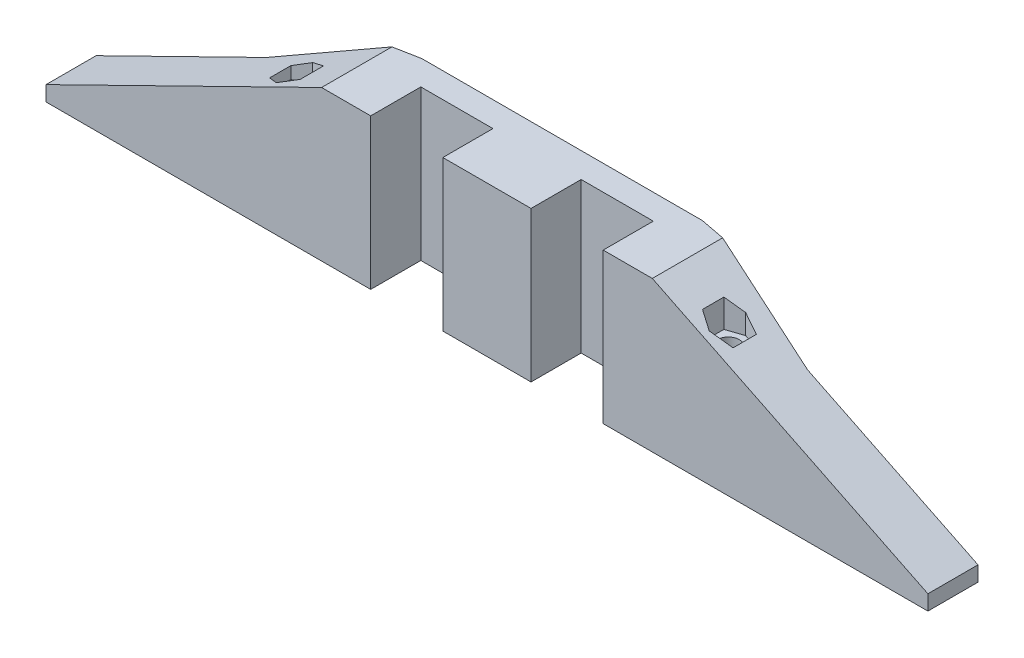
SolidWorks part; units mm, degrees
ref_plane "Спереди" through (0, 0, 0) normal (0, 0, 1) x (1, 0, 0)
ref_plane "Сверху" through (0, 0, 0) normal (0, 1, 0) x (1, 0, 0)
ref_plane "Справа" through (0, 0, 0) normal (1, 0, 0) x (0, 0, -1)
other "Configuration Table"
sketch "Эскиз1" plane through (0, 0, 0) normal (0, 1, 0) x (1, 0, 0)
  line L0 (-48.2163, 22.9032) -> (-72.2163, 22.9032)
  line L1 (-72.2163, 22.9032) -> (-72.2163, 7.9032)
  line L2 (-72.2163, 7.9032) -> (-67.4163, 7.9032)
  line L3 (-67.4163, 7.9032) -> (-67.4163, 17.9032)
  line L4 (-67.4163, 17.9032) -> (-53.0163, 17.9032)
  line L5 (-53.0163, 17.9032) -> (-53.0163, 7.9032)
  line L6 (-53.0163, 7.9032) -> (-48.2163, 7.9032)
  line L7 (-48.2163, 7.9032) -> (-48.2163, 22.9032)
  line L8 (-40.2163, 22.9032) -> (-40.2163, 7.9032)
  line L9 (-40.2163, 7.9032) -> (-35.4163, 7.9032)
  line L10 (-35.4163, 7.9032) -> (-35.4163, 17.9032)
  line L11 (-35.4163, 17.9032) -> (-21.0163, 17.9032)
  line L12 (-21.0163, 17.9032) -> (-21.0163, 7.9032)
  line L13 (-21.0163, 7.9032) -> (-16.2163, 7.9032)
  line L14 (-16.2163, 7.9032) -> (-16.2163, 22.9032)
  line L15 (-16.2163, 22.9032) -> (-40.2163, 22.9032)
  dimension "D1" = 24
  dimension "D2" = 15
  dimension "D3" = 15
  dimension "D4" = 24
  dimension "D5" = 4.8
  dimension "D6" = 4.8
  dimension "D7" = 4.8
  dimension "D8" = 4.8
  dimension "D9" = 10
  dimension "D10" = 10
extrude "Бобышка-Вытянуть1" add sketch "Эскиз1" along normal blind 30
sketch "Эскиз2" plane through (-48.2163, 0, 0) normal (1, 0, 0) x (0, 0, -1)
  line L4 (7.9032, 0) -> (22.9032, 0)
  line L5 (22.9032, 0) -> (22.9032, 30)
  line L6 (22.9032, 30) -> (7.9032, 30)
  line L7 (7.9032, 30) -> (7.9032, 0)
  line L8 (7.9032, 0) -> (22.9032, 0)
  line L9 (22.9032, 0) -> (22.9032, 30)
  line L10 (22.9032, 30) -> (7.9032, 30)
  line L11 (7.9032, 30) -> (7.9032, 0)
  dimension "D1" = 0
extrude "Бобышка-Вытянуть2" add sketch "Эскиз2" along normal up to surface (8 mm away)
sketch "Эскиз3" plane through (-72.2163, 0, 0) normal (-1, 0, 0) x (0, 0, 1)
  line L0 (-17.9032, 30) -> (-17.9032, 0) construction
  line L1 (-17.9032, 30) -> (-17.9032, 0)
  line L4 (-22.9032, 0) -> (-7.9032, 0)
  line L5 (-7.9032, 0) -> (-7.9032, 30)
  line L6 (-7.9032, 30) -> (-22.9032, 30)
  line L7 (-22.9032, 30) -> (-22.9032, 0)
  line L8 (-22.9032, 0) -> (-7.9032, 0)
  line L9 (-7.9032, 0) -> (-7.9032, 30)
  line L10 (-7.9032, 30) -> (-22.9032, 30)
  line L11 (-22.9032, 30) -> (-22.9032, 0)
  dimension "D1" = 0
extrude "Бобышка-Вытянуть3" add sketch "Эскиз3" along normal blind 60 contours L1 M7 M5 M6
sketch "Эскиз4" plane through (-16.2163, 0, 0) normal (1, 0, 0) x (0, 0, -1)
  line L0 (17.9032, 30) -> (17.9032, 0) construction
  line L1 (17.9032, 30) -> (17.9032, 0)
  line L4 (7.9032, 0) -> (22.9032, 0)
  line L5 (22.9032, 0) -> (22.9032, 30)
  line L6 (22.9032, 30) -> (7.9032, 30)
  line L7 (7.9032, 30) -> (7.9032, 0)
  line L8 (7.9032, 0) -> (22.9032, 0)
  line L9 (22.9032, 0) -> (22.9032, 30)
  line L10 (22.9032, 30) -> (7.9032, 30)
  line L11 (7.9032, 30) -> (7.9032, 0)
  dimension "D1" = 0
extrude "Бобышка-Вытянуть4" add sketch "Эскиз4" along normal blind 60 contours L1 M7 M8 M5
sketch "Эскиз8" plane through (0, 0, 0) normal (0, -1, 0) x (1, 0, 0)
  line L0 (-72.2163, -22.9032) -> (-98.2163, -17.9032)
  line L1 (-16.2163, -22.9032) -> (9.7837, -17.9032)
  line L16 (-72.2163, -22.9032) -> (-16.2163, -22.9032)
  line L17 (-16.2163, -22.9032) -> (-16.2163, -17.9032)
  line L18 (-16.2163, -17.9032) -> (43.7837, -17.9032)
  line L19 (43.7837, -17.9032) -> (43.7837, -7.9032)
  line L20 (43.7837, -7.9032) -> (-21.0163, -7.9032)
  line L21 (-21.0163, -7.9032) -> (-21.0163, -17.9032)
  line L22 (-21.0163, -17.9032) -> (-35.4163, -17.9032)
  line L23 (-35.4163, -17.9032) -> (-35.4163, -7.9032)
  line L24 (-35.4163, -7.9032) -> (-53.0163, -7.9032)
  line L25 (-53.0163, -7.9032) -> (-53.0163, -17.9032)
  line L26 (-53.0163, -17.9032) -> (-67.4163, -17.9032)
  line L27 (-67.4163, -17.9032) -> (-67.4163, -7.9032)
  line L28 (-67.4163, -7.9032) -> (-132.2163, -7.9032)
  line L29 (-132.2163, -7.9032) -> (-132.2163, -17.9032)
  line L30 (-132.2163, -17.9032) -> (-72.2163, -17.9032)
  line L31 (-72.2163, -17.9032) -> (-72.2163, -22.9032)
  line L32 (-72.2163, -22.9032) -> (-16.2163, -22.9032)
  line L33 (-16.2163, -22.9032) -> (-16.2163, -17.9032)
  line L34 (-16.2163, -17.9032) -> (43.7837, -17.9032)
  line L35 (43.7837, -17.9032) -> (43.7837, -7.9032)
  line L36 (43.7837, -7.9032) -> (-21.0163, -7.9032)
  line L37 (-21.0163, -7.9032) -> (-21.0163, -17.9032)
  line L38 (-21.0163, -17.9032) -> (-35.4163, -17.9032)
  line L39 (-35.4163, -17.9032) -> (-35.4163, -7.9032)
  line L40 (-35.4163, -7.9032) -> (-53.0163, -7.9032)
  line L41 (-53.0163, -7.9032) -> (-53.0163, -17.9032)
  line L42 (-53.0163, -17.9032) -> (-67.4163, -17.9032)
  line L43 (-67.4163, -17.9032) -> (-67.4163, -7.9032)
  line L44 (-67.4163, -7.9032) -> (-132.2163, -7.9032)
  line L45 (-132.2163, -7.9032) -> (-132.2163, -17.9032)
  line L46 (-132.2163, -17.9032) -> (-72.2163, -17.9032)
  line L47 (-72.2163, -17.9032) -> (-72.2163, -22.9032)
  dimension "D2" = 26
  dimension "D3" = 26
  dimension "D1" = 0
extrude "Бобышка-Вытянуть5" add sketch "Эскиз8" against normal up to surface (30 mm away) contours L1 M20 M21 | L0 M34 M33
sketch "Эскиз5" plane through (0, 0, -17.9032) normal (0, 0, -1) x (-1, 0, 0)
  line L0 (11.2163, 30) -> (-43.7837, 3)
  line L1 (77.2163, 30) -> (132.2163, 3)
  line L4 (98.2163, 30) -> (98.2163, 0)
  line L5 (98.2163, 0) -> (132.2163, 0)
  line L6 (132.2163, 0) -> (132.2163, 30)
  line L7 (132.2163, 30) -> (98.2163, 30)
  line L9 (98.2163, 0) -> (132.2163, 0)
  line L10 (132.2163, 0) -> (132.2163, 30)
  line L11 (132.2163, 30) -> (98.2163, 30)
  line L12 (-9.7837, 0) -> (-9.7837, 30)
  line L13 (-9.7837, 30) -> (-43.7837, 30)
  line L14 (-43.7837, 30) -> (-43.7837, 0)
  line L15 (-43.7837, 0) -> (-9.7837, 0)
  line L17 (-9.7837, 30) -> (-43.7837, 30)
  line L18 (-43.7837, 30) -> (-43.7837, 0)
  line L19 (-43.7837, 0) -> (-9.7837, 0)
  line L22 (98.2163, 30) -> (98.2163, 0)
  line L23 (-9.7837, 0) -> (-9.7837, 30)
  line L24 (16.2163, 0) -> (16.2163, 30)
  line L25 (16.2163, 30) -> (-9.7837, 30)
  line L26 (-9.7837, 30) -> (-9.7837, 0)
  line L27 (-9.7837, 0) -> (16.2163, 0)
  line L28 (16.2163, 0) -> (16.2163, 30)
  line L29 (16.2163, 30) -> (-9.7837, 30)
  line L30 (-9.7837, 30) -> (-9.7837, 0)
  line L31 (-9.7837, 0) -> (16.2163, 0)
  line L32 (98.2163, 30) -> (72.2163, 30)
  line L33 (72.2163, 30) -> (72.2163, 0)
  line L34 (72.2163, 0) -> (98.2163, 0)
  line L35 (98.2163, 0) -> (98.2163, 30)
  line L36 (98.2163, 30) -> (72.2163, 30)
  line L37 (72.2163, 30) -> (72.2163, 0)
  line L38 (72.2163, 0) -> (98.2163, 0)
  line L39 (98.2163, 0) -> (98.2163, 30)
  dimension "D3" = 0
  dimension "D4" = 3
  dimension "D5" = 0
  dimension "D6" = 3
  dimension "D7" = 5
  dimension "D8" = 5
  dimension "D1" = 0
  dimension "D2" = 0
extrude "Вырез-Вытянуть1" cut sketch "Эскиз5" against normal up to surface and the other way up to surface contours L1 M22 M21 | L17 L18 L0 | L0 L29 L23 | L36 L1 M23
sketch "Эскиз6" plane through (0, 0, 0) normal (0, -1, 0) x (1, 0, 0)
  line L0 (-132.2163, -12.9032) -> (43.7837, -12.9032) construction
  line L1 (-87.4163, -5.7638) -> (-87.4163, -22.3791) construction
  line L2 (-1.0163, -4.7491) -> (-1.0163, -26.0573) construction
  line L16 (-72.2163, -22.9032) -> (-16.2163, -22.9032)
  line L17 (-16.2163, -22.9032) -> (9.7837, -17.9032)
  line L18 (9.7837, -17.9032) -> (43.7837, -17.9032)
  line L19 (43.7837, -17.9032) -> (43.7837, -7.9032)
  line L20 (43.7837, -7.9032) -> (-21.0163, -7.9032)
  line L21 (-21.0163, -7.9032) -> (-21.0163, -17.9032)
  line L22 (-21.0163, -17.9032) -> (-35.4163, -17.9032)
  line L23 (-35.4163, -17.9032) -> (-35.4163, -7.9032)
  line L24 (-35.4163, -7.9032) -> (-53.0163, -7.9032)
  line L25 (-53.0163, -7.9032) -> (-53.0163, -17.9032)
  line L26 (-53.0163, -17.9032) -> (-67.4163, -17.9032)
  line L27 (-67.4163, -17.9032) -> (-67.4163, -7.9032)
  line L28 (-67.4163, -7.9032) -> (-132.2163, -7.9032)
  line L29 (-132.2163, -7.9032) -> (-132.2163, -17.9032)
  line L30 (-132.2163, -17.9032) -> (-98.2163, -17.9032)
  line L31 (-16.2163, -22.9032) -> (9.7837, -17.9032)
  line L32 (-72.2163, -22.9032) -> (-16.2163, -22.9032)
  line L34 (9.7837, -17.9032) -> (43.7837, -17.9032)
  line L35 (43.7837, -17.9032) -> (43.7837, -7.9032)
  line L36 (43.7837, -7.9032) -> (-21.0163, -7.9032)
  line L37 (-21.0163, -7.9032) -> (-21.0163, -17.9032)
  line L38 (-21.0163, -17.9032) -> (-35.4163, -17.9032)
  line L39 (-35.4163, -17.9032) -> (-35.4163, -7.9032)
  line L40 (-35.4163, -7.9032) -> (-53.0163, -7.9032)
  line L41 (-53.0163, -7.9032) -> (-53.0163, -17.9032)
  line L42 (-53.0163, -17.9032) -> (-67.4163, -17.9032)
  line L43 (-67.4163, -17.9032) -> (-67.4163, -7.9032)
  line L44 (-67.4163, -7.9032) -> (-132.2163, -7.9032)
  line L45 (-132.2163, -7.9032) -> (-132.2163, -17.9032)
  line L46 (-132.2163, -17.9032) -> (-98.2163, -17.9032)
  line L51 (-98.2163, -17.9032) -> (-72.2163, -22.9032)
  line L52 (-98.2163, -17.9032) -> (-72.2163, -22.9032)
  circle A0 centre (-87.4163, -12.9032) radius 2.1
  circle A1 centre (-1.0163, -12.9032) radius 2.1
  point P22 (0, 0)
  point P24 (0, 0)
  dimension "D4" = 4.2
  dimension "D5" = 4.2
  dimension "D2" = 20
  dimension "D3" = 20
  dimension "D1" = 0
extrude "Вырез-Вытянуть2" cut sketch "Эскиз6" against normal blind 60 contours A1 | A0
sketch "Эскиз7" plane through (0, 30, 0) normal (0, 1, 0) x (1, 0, 0)
  line L0 (-1.0163, 16.3331) -> (2.2337, 15.2369)
  line L1 (-1.0163, 17.3749) -> (-1.0163, 7.9144) construction
  line L2 (-1.3232, 9.3698) -> (2.2337, 10.5695)
  line L3 (-4.2663, 10.9722) -> (-1.3232, 9.3698)
  line L4 (-4.2663, 15.2369) -> (-4.2663, 10.9722)
  line L5 (-4.2663, 15.2369) -> (-1.0163, 16.3331)
  line L6 (2.2337, 15.2369) -> (2.2337, 10.5695)
  line L7 (-84.1663, 15.2369) -> (-84.1663, 10.5695)
  line L8 (-90.6663, 10.9722) -> (-87.7232, 9.3698)
  line L9 (-90.6663, 15.2369) -> (-87.4163, 16.3331)
  line L10 (-87.7232, 9.3698) -> (-84.1663, 10.5695)
  line L11 (-87.4163, 17.3749) -> (-87.4163, 7.9144) construction
  line L12 (-87.4163, 16.3331) -> (-84.1663, 15.2369)
  line L13 (-90.6663, 15.2369) -> (-90.6663, 10.9722)
  circle A0 centre (-87.4163, 12.9032) radius 2.1 construction
  circle A1 centre (-87.4163, 12.9032) radius 2.1
  circle A2 centre (-1.0163, 12.9032) radius 2.1 construction
  circle A3 centre (-1.0163, 12.9032) radius 2.1
  circle A4 centre (-87.4163, 12.9032) radius 2.1
  circle A5 centre (-1.0163, 12.9032) radius 3.25 construction
  circle A6 centre (-1.0163, 12.9032) radius 2.1
  circle A7 centre (-87.4163, 12.9032) radius 2.2
  circle A8 centre (-87.4163, 12.9032) radius 3.25 construction
  circle A9 centre (-1.0163, 12.9032) radius 2.2
  dimension "D1" = 4.2
  dimension "D2" = 4.2
extrude "Вырез-Вытянуть3" cut sketch "Эскиз7" against normal blind 9 contours L6 L0 L5 L4 L3 L2 A6 | L9 L13 L8 L10 L7 L12 A4 | A7 A1 | A9 A3
